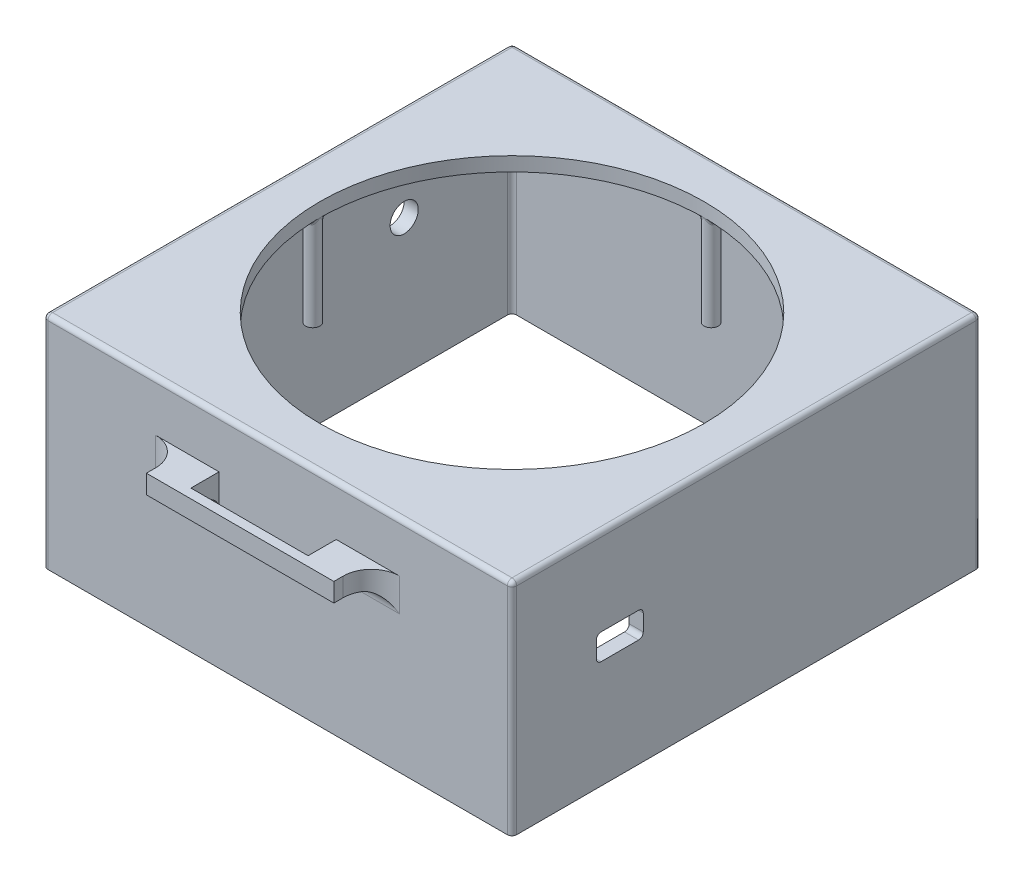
SolidWorks part; units mm, degrees
ref_plane "Front Plane" through (0, 0, 0) normal (0, 0, 1) x (1, 0, 0)
ref_plane "Top Plane" through (0, 0, 0) normal (0, 1, 0) x (1, 0, 0)
ref_plane "Right Plane" through (0, 0, 0) normal (1, 0, 0) x (0, 0, -1)
sketch "Sketch1" plane through (0, 0, 0) normal (0, 1, 0) x (1, 0, 0)
  line L1 (-50, 50) -> (50, 50)
  line L2 (-50, 50) -> (-50, -50)
  line L3 (-50, -50) -> (50, -50)
  line L4 (50, 50) -> (50, -50)
  line L5 (-50, 50) -> (50, -50) construction
  line L6 (-50, -50) -> (50, 50) construction
  point P0 (0, 0)
  dimension "D1" = 100
  dimension "D2" = 100
extrude "Boss-Extrude1" add sketch "Sketch1" along normal blind 44.25
shell "Shell1" thickness 3
fillet "Fillet1" radius 1 16 edges at (0, 41.25, -47) (-47, 41.25, 0) (0, 41.25, 47) (47, 41.25, 0) (0, 44.25, 50) (-50, 44.25, 0) (0, 44.25, -50) (50, 44.25, 0) (-47, 20.625, -47) (47, 20.625, 47) (47, 20.625, -47) (-50, 22.125, -50) (50, 22.125, -50) (50, 22.125, 50) (-50, 22.125, 50) (-47, 20.625, 47)
sketch "Sketch2" plane through (0, 41.25, 0) normal (0, -1, 0) x (1, 0, 0)
  line L0 (0, 0) -> (0, -46) construction
  line L1 (-46, -46) -> (46, -46) construction
  circle A0 centre (0, -42.5) radius 1.5
  circle A1 centre (-42.5, 0) radius 1.5
  circle A2 centre (0, 42.5) radius 1.5
  circle A3 centre (42.5, 0) radius 1.5
  point P16 (0, 0)
  dimension "D1" = 3
  dimension "D2" = 42.5
  dimension "D3" = 4
extrude "Boss-Extrude2" add sketch "Sketch2" along normal blind 20
sketch "Sketch3" plane through (0, 41.25, 0) normal (0, -1, 0) x (-1, 0, 0)
  circle A0 centre (0, 0) radius 41
  dimension "D1" = 82
extrude "Cut-Extrude1" cut sketch "Sketch3" against normal through all
sketch "Sketch7" plane through (50, 0, 0) normal (1, 0, 0) x (0, 0, -1)
  line L0 (0, 0) -> (0, 43.25) construction
  line L1 (-49, 0) -> (49, 0) construction
  line L2 (49, 43.25) -> (-49, 43.25) construction
  line L3 (-50, 0) -> (-50, 43.25) construction
  line L4 (-31, 25.75) -> (-23, 25.75)
  line L5 (-32, 24.75) -> (-32, 21.25)
  line L6 (-31, 20.25) -> (-23, 20.25)
  line L7 (-22, 24.75) -> (-22, 21.25)
  line L8 (-32, 25.75) -> (-22, 20.25) construction
  line L9 (-32, 20.25) -> (-22, 25.75) construction
  arc A0 (-23, 20.25) -> (-22, 21.25) centre (-23, 21.25) ccw
  arc A1 (-32, 21.25) -> (-31, 20.25) centre (-31, 21.25) ccw
  arc A2 (-31, 25.75) -> (-32, 24.75) centre (-31, 24.75) ccw
  arc A3 (-23, 25.75) -> (-22, 24.75) centre (-23, 24.75) cw
  point P6 (-27, 23)
  dimension "D5" = 1
  dimension "D1" = 18
  dimension "D2" = 20.25
  dimension "D3" = 10
  dimension "D4" = 5.5
extrude "Cut-Extrude5" cut sketch "Sketch7" against normal blind 10
sketch "Sketch8" plane through (-50, 0, 0) normal (-1, 0, 0) x (0, 0, 1)
  line L0 (0, 0) -> (0, 43.25) construction
  line L1 (-49, 0) -> (49, 0) construction
  line L2 (49, 43.25) -> (-49, 43.25) construction
  line L3 (50, 43.25) -> (50, 0) construction
  line L4 (23.5, 28.8) -> (28.5, 28.8)
  line L5 (23.5, 28.8) -> (23.5, 23.8)
  line L6 (23.5, 23.8) -> (28.5, 23.8)
  line L7 (28.5, 28.8) -> (28.5, 23.8)
  line L8 (23.5, 28.8) -> (28.5, 23.8) construction
  line L9 (23.5, 23.8) -> (28.5, 28.8) construction
  line L10 (-49, 44.25) -> (49, 44.25) construction
  line L11 (26, 26.3) -> (-49, 26.3) construction
  line L12 (-49, 43.25) -> (-49, 0) construction
  circle A0 centre (-24, 26.3) radius 3
  point P6 (26, 26.3)
  dimension "D5" = 6
  dimension "D1" = 5
  dimension "D2" = 5
  dimension "D3" = 21.5
  dimension "D4" = 15.45
  dimension "D6" = 25
extrude "Cut-Extrude6" cut sketch "Sketch8" against normal blind 10
sketch "Sketch9" plane through (0, 0, 50) normal (0, 0, 1) x (1, 0, 0)
  line L0 (0, 0) -> (0, 43.25) construction
  line L1 (-49, 0) -> (49, 0) construction
  line L2 (49, 43.25) -> (-49, 43.25) construction
  line L4 (20, 29.578) -> (-20, 29.578)
  line L5 (20, 29.578) -> (20, 33.578)
  line L6 (20, 33.578) -> (-20, 33.578)
  line L7 (-20, 29.578) -> (-20, 33.578)
  line L8 (20, 29.578) -> (-20, 33.578) construction
  line L9 (20, 33.578) -> (-20, 29.578) construction
  point P6 (0, 31.578)
  dimension "D1" = 40
  dimension "D2" = 4
extrude "Boss-Extrude3" add sketch "Sketch9" along normal blind 8
fillet "Fillet2" radius 6 2 edges at (-20, 31.578, 50) (20, 31.578, 50)
sketch "Sketch10" plane through (0, 33.578, 0) normal (0, 1, 0) x (1, 0, 0)
  line L0 (0, -58) -> (0, -50) construction
  line L1 (20, -58) -> (-20, -58) construction
  line L2 (26, -50) -> (-26, -50) construction
  line L4 (12.5, -56) -> (-12.5, -56)
  line L5 (12.5, -56) -> (12.5, -50)
  line L6 (12.5, -50) -> (-12.5, -50)
  line L7 (-12.5, -56) -> (-12.5, -50)
  line L8 (12.5, -56) -> (-12.5, -50) construction
  line L9 (12.5, -50) -> (-12.5, -56) construction
  point P6 (0, -53)
  dimension "D1" = 6
  dimension "D2" = 25
  dimension "D3" = 0
extrude "Cut-Extrude7" cut sketch "Sketch10" against normal through all both and the other way through all
mirror "Mirror4" about plane through (0, 0, 0) normal (0, 0, 1) of "Boss-Extrude3"
fillet "Fillet3" radius 6 2 edges at (20, 31.578, -50) (-20, 31.578, -50)
mirror "Mirror6" about plane through (0, 0, 0) normal (0, 0, 1) of "Cut-Extrude7"
fillet "Fillet4" radius 3 4 edges at (19.25, 29.578, 50) (-19.25, 29.578, 50) (-19.25, 29.578, -50) (19.25, 29.578, -50)
fillet "Fillet5" radius 1 4 edges at (0, 41.25, 44) (-42.5, 41.25, 1.5) (0, 41.25, -41) (42.5, 41.25, 1.5)
sketch "Sketch11" plane through (0, 0, 0) normal (0, -1, 0) x (1, 0, 0)
  line L0 (-47, -46) -> (-47, 46) construction
  line L1 (-47, -46) -> (-47, 46)
  line L2 (46, -47) -> (-46, -47) construction
  line L3 (47, 46) -> (47, -46) construction
  line L4 (-50, 49) -> (-50, -49)
  line L5 (-49, -50) -> (49, -50)
  line L6 (50, -49) -> (50, 49)
  line L7 (49, 50) -> (-49, 50)
  line L8 (-50, 49) -> (-50, -49)
  line L9 (-49, -50) -> (49, -50)
  line L10 (50, -49) -> (50, 49)
  line L11 (49, 50) -> (-49, 50)
  line L12 (-46, 47) -> (46, 47) construction
  line L13 (46, -47) -> (-46, -47)
  line L14 (47, 46) -> (47, -46)
  line L15 (-46, 47) -> (46, 47)
  arc A0 (-47, -46) -> (-46, -47) centre (-46, -46) ccw construction
  arc A1 (46, -47) -> (47, -46) centre (46, -46) ccw construction
  arc A2 (47, 46) -> (46, 47) centre (46, 46) ccw construction
  arc A3 (-46, 47) -> (-47, 46) centre (-46, 46) ccw construction
  arc A4 (-50, -49) -> (-49, -50) centre (-49, -49) ccw
  arc A5 (49, -50) -> (50, -49) centre (49, -49) ccw
  arc A6 (50, 49) -> (49, 50) centre (49, 49) ccw
  arc A7 (-49, 50) -> (-50, 49) centre (-49, 49) ccw
  arc A8 (-50, -49) -> (-49, -50) centre (-49, -49) ccw
  arc A9 (49, -50) -> (50, -49) centre (49, -49) ccw
  arc A10 (50, 49) -> (49, 50) centre (49, 49) ccw
  arc A11 (-49, 50) -> (-50, 49) centre (-49, 49) ccw
  arc A12 (-47, -46) -> (-46, -47) centre (-46, -46) ccw
  arc A13 (46, -47) -> (47, -46) centre (46, -46) ccw
  arc A14 (47, 46) -> (46, 47) centre (46, 46) ccw
  arc A15 (-46, 47) -> (-47, 46) centre (-46, 46) ccw
  dimension "D1" = 0
extrude "Boss-Extrude4" add sketch "Sketch11" along normal blind 2.72
